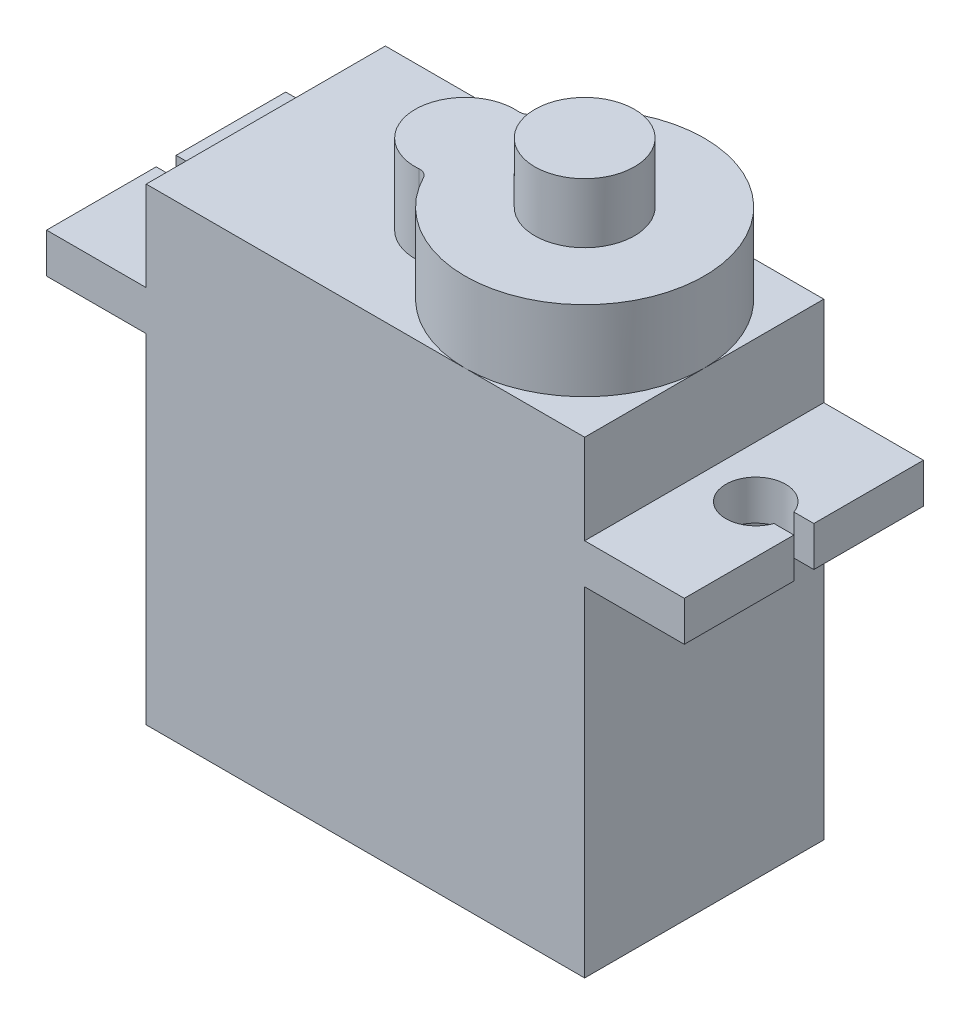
SolidWorks part; units mm, degrees
ref_plane "Front Plane" through (0, 0, 0) normal (0, 0, 1) x (1, 0, 0)
ref_plane "Top Plane" through (0, 0, 0) normal (0, 1, 0) x (1, 0, 0)
ref_plane "Right Plane" through (0, 0, 0) normal (1, 0, 0) x (0, 0, -1)
sketch "Sketch1" plane through (0, 0, 0) normal (0, 1, 0) x (1, 0, 0)
  line L1 (-11, -6) -> (11, -6)
  line L2 (-11, -6) -> (-11, 6)
  line L3 (-11, 6) -> (11, 6)
  line L4 (11, -6) -> (11, 6)
  line L5 (-11, -6) -> (11, 6) construction
  line L6 (-11, 6) -> (11, -6) construction
  point P0 (0, 0)
  dimension "D1" = 12
  dimension "D2" = 22
extrude "Boss-Extrude1" add sketch "Sketch1" along normal blind 23.5
sketch "Sketch2" plane through (0, 0, 0) normal (0, -1, 0) x (1, 0, 0)
  line L0 (0, 6) -> (0, -6) construction
  line L1 (11, 6) -> (16, 6)
  line L2 (11, 6) -> (11, -6)
  line L3 (11, -6) -> (16, -6)
  line L4 (16, 6) -> (16, -6)
  line L5 (-11, 6) -> (11, 6) construction
  line L6 (11, -6) -> (-11, -6) construction
  line L7 (-16, 6) -> (-16, -6)
  line L8 (-11, -6) -> (-16, -6)
  line L9 (-11, 6) -> (-11, -6)
  line L10 (-11, 6) -> (-16, 6)
  line L11 (-16, -0.5) -> (-15, -0.5)
  line L12 (-16, 0.5) -> (-15, 0.5)
  line L13 (-16, 0.5) -> (-15, 0.5) construction
  line L14 (16, 0.5) -> (15, 0.5)
  line L15 (16, -0.5) -> (15, -0.5)
  circle A0 centre (-13.5858, 0) radius 1.5
  circle A1 centre (13.5858, 0) radius 1.5
  dimension "D2" = 3
  dimension "D1" = 32
  dimension "D3" = 1
  dimension "D4" = 1
extrude "Boss-Extrude2" add sketch "Sketch2" against normal blind 2 from offset 17 contours A0 L11 L7 L8 L10 L12 M6 | L15 A1 L14 L4 L1 L3 M4
sketch "Sketch3" plane through (0, 23.5, 0) normal (0, 1, 0) x (1, 0, 0)
  line L0 (11, 6) -> (11, -6) construction
  line L1 (11, 6) -> (-11, 6) construction
  line L2 (-11, -6) -> (11, -6) construction
  arc A0 (-0.3269, -2.7611) -> (-0.3269, 2.7611) centre (5, 0) ccw
  arc A1 (-0.809, 2.4927) -> (-0.809, -2.4927) centre (-1, 0) ccw
  arc A2 (-0.809, -2.4927) -> (-0.3269, -2.7611) centre (-0.7708, -2.9912) cw
  arc A3 (-0.809, 2.4927) -> (-0.3269, 2.7611) centre (-0.7708, 2.9912) ccw
  dimension "D1" = 5
  dimension "D3" = 0.5
  dimension "D2" = 6
extrude "Boss-Extrude3" add sketch "Sketch3" along normal blind 4
sketch "Sketch4" plane through (0, 27.5, 0) normal (0, 1, 0) x (1, 0, 0)
  circle A0 centre (5, 0) radius 2.5
  dimension "D1" = 5
extrude "Boss-Extrude4" add sketch "Sketch4" along normal blind 3
